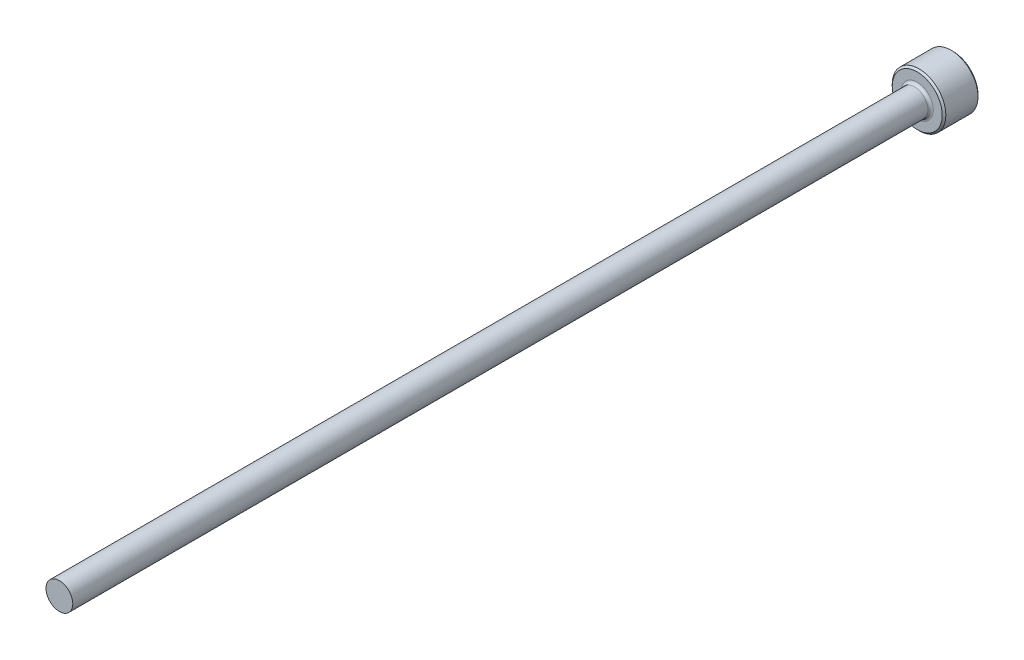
SolidWorks part; units mm, degrees
ref_plane "Front Plane" through (0, 0, 0) normal (0, 0, 1) x (1, 0, 0)
ref_plane "Top Plane" through (0, 0, 0) normal (0, 1, 0) x (1, 0, 0)
ref_plane "Right Plane" through (0, 0, 0) normal (1, 0, 0) x (0, 0, -1)
sketch "Sketch1" plane through (0, 0, 0) normal (1, 0, 0) x (0, 0, -1)
  line L0 (0, 0) -> (0, 3)
  line L1 (0, 3.3) -> (0, -3.3) construction
  line L2 (0, 3) -> (-4, 3)
  line L3 (-4, 3) -> (-4, 1.8)
  line L4 (-4.3, 1.5) -> (-100, 1.5)
  line L5 (-100, 1.5) -> (-100, 0)
  line L6 (3.3, 0) -> (-3.3, 0) construction
  line L7 (-100, 0) -> (0, 0)
  line L8 (-109.0506, 0) -> (16.9928, 0) construction
  arc A0 (-4, 1.8) -> (-4.3, 1.5) centre (-4.3, 1.8) cw
  dimension "D1" = 0.3
  dimension "D2" = 6
  dimension "D3" = 3
  dimension "D4" = 100
  dimension "D5" = 4
revolve "Revolve1" add sketch "Sketch1" angle 360 about L8
chamfer "Chamfer1" distance 0.2 angle 45 2 edges at (3, 0, 0) (3, 0, 4)
